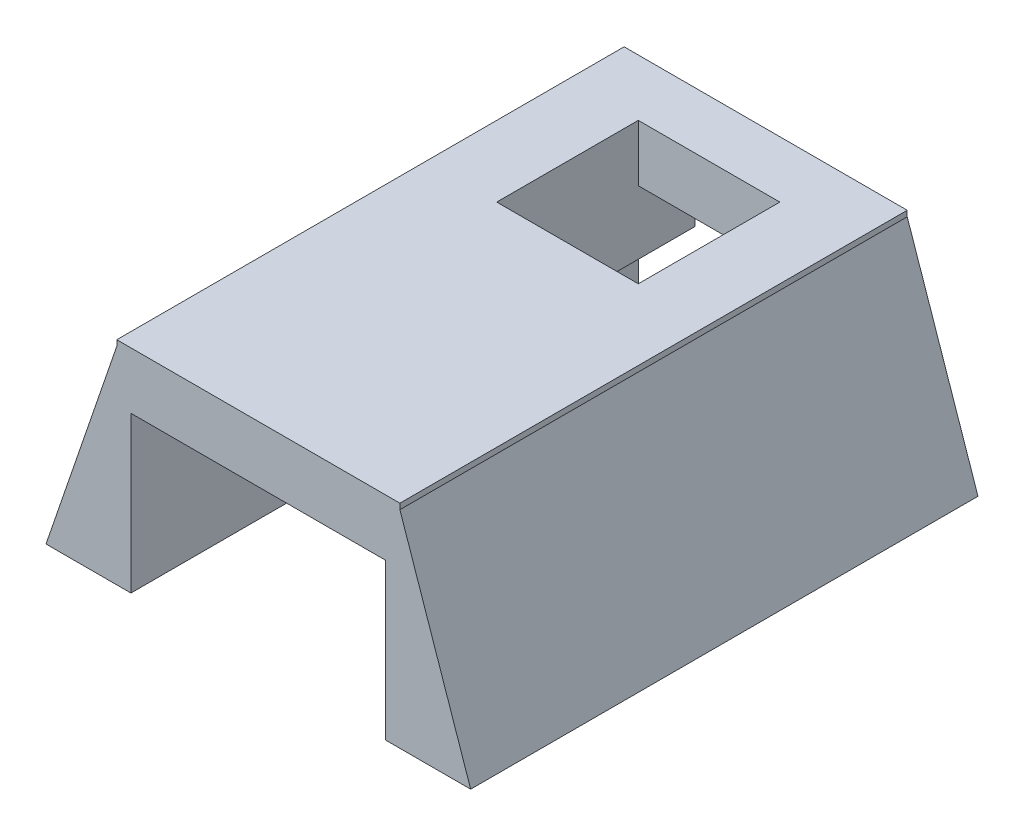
SolidWorks part; units mm, degrees
ref_plane "Front Plane" through (0, 0, 0) normal (0, 0, 1) x (1, 0, 0)
ref_plane "Top Plane" through (0, 0, 0) normal (0, 1, 0) x (1, 0, 0)
ref_plane "Right Plane" through (0, 0, 0) normal (1, 0, 0) x (0, 0, -1)
sketch "Sketch2" plane through (0, 0, 0) normal (0, 0, 1) x (1, 0, 0)
  line L0 (-7.5, 0) -> (-5, 7.3)
  line L1 (-5, 7.3) -> (-5, 7.5)
  line L2 (-5, 7.5) -> (5, 7.5)
  line L3 (0, 1.6079) -> (0, -0.5641) construction
  line L4 (-7.5, 0) -> (7.5, 0)
  line L5 (5, 7.3) -> (5, 7.5)
  line L6 (7.5, 0) -> (5, 7.3)
  point P9 (0, 0)
  point P10 (0, 7.5)
  dimension "D1" = 0.2
  dimension "D2" = 2.5
  dimension "D3" = 7.5
  dimension "D4" = 5
extrude "Boss-Extrude1" add sketch "Sketch2" along normal blind 19.9205
sketch "Sketch3" plane through (0, 0, 0) normal (0, 1, 0) x (1, 0, 0)
  line L0 (0, -19.9205) -> (0, -13.5866) construction
  line L1 (5, -19.9205) -> (-5, -19.9205) construction
  line L2 (-4.5, -19.9205) -> (4.5, -19.9205)
  line L3 (-2.5, 0) -> (2.5, 0)
  line L4 (-7.5, 0) -> (7.5, 0) construction
  line L5 (-2.5, -11) -> (-2.5, 0)
  line L7 (-2.5, -11) -> (-4.5, -11)
  line L8 (-4.5, -11) -> (-4.5, -19.9205)
  line L9 (-7.5, -19.9205) -> (7.5, -19.9205) construction
  line L10 (4.5, -11) -> (4.5, -19.9205)
  line L11 (2.5, -11) -> (4.5, -11)
  line L12 (2.5, -11) -> (2.5, 0)
  point P6 (0, -19.9205)
  point P10 (0, -19.9205)
  point P11 (0, 0)
  point P21 (0, 0)
  dimension "D1" = 2.5
  dimension "D2" = 9
  dimension "D3" = 11
extrude "Cut-Extrude3" cut sketch "Sketch3" along normal blind 5.5
sketch "Sketch5" plane through (0, 0, 0) normal (0, 0, -1) x (-1, 0, 0)
  line L0 (-4.5, 0) -> (-4.5, 3.25)
  line L1 (-2.5, 0) -> (-7.5, 0) construction
  line L2 (-4.5, 3.25) -> (4.5, 3.25)
  line L3 (4.5, 3.25) -> (4.5, 0)
  line L4 (4.5, 0) -> (-4.5, 0)
  line L5 (-2.5, 5.5) -> (2.5, 5.5) construction
  point P10 (0, 5.5)
  point P11 (0, 3.25)
  dimension "D1" = 9
  dimension "D2" = 2.25
extrude "Cut-Extrude5" cut sketch "Sketch5" against normal through all
sketch "Sketch6" plane through (0, 3.25, 0) normal (0, -1, 0) x (1, 0, 0)
  line L0 (6, 0) -> (-6, 0)
  line L1 (4.5, 0) -> (7.5, 0) construction
  line L2 (-7.5, 0) -> (-4.5, 0) construction
  line L3 (-6, 0) -> (-6, 2)
  line L4 (-6, 2) -> (6, 2)
  line L5 (6, 2) -> (6, 0)
  dimension "D1" = 2
extrude "Boss-Extrude2" add sketch "Sketch6" along normal up to surface (3.25 mm away)
sketch "Sketch7" plane through (0, 0, 0) normal (0, -1, 0) x (1, 0, 0)
  line L0 (3.5589, 0) -> (3.5589, 2)
  line L1 (-7.5, 0) -> (7.5, 0) construction
  line L2 (-4.5, 2) -> (4.5, 2) construction
  line L3 (3.5589, 2) -> (-3.5, 2)
  line L4 (-2.5, 2) -> (-4.5, 2) construction
  line L5 (-3.5, 2) -> (-3.5, 0)
  line L6 (-3.5, 0) -> (3.5589, 0)
extrude "Boss-Extrude3" add sketch "Sketch7" against normal blind 6
sketch "Sketch4" plane through (0, 7.5, 0) normal (0, 1, 0) x (1, 0, 0)
  line L0 (0, 0) -> (0, -11.2083) construction
  line L2 (2.5, -9) -> (-2.5, -9)
  line L3 (2.5, -9) -> (2.5, -4)
  line L4 (2.5, -4) -> (-2.5, -4)
  line L5 (-2.5, -9) -> (-2.5, -4)
  line L6 (2.5, -9) -> (-2.5, -4) construction
  line L7 (2.5, -4) -> (-2.5, -9) construction
  line L9 (2.5, -11) -> (2.5, -2) construction
  point P3 (0, -6.5)
  point P10 (2.5, -6.5)
  point P13 (2.5, -6.5)
  dimension "D1" = 5
  dimension "D2" = 5
extrude "Cut-Extrude4" cut sketch "Sketch4" against normal through all
sketch "Sketch8" plane through (0, 0, 0) normal (0, -1, 0) x (1, 0, 0)
  line L0 (-7.5, 19.9205) -> (-7.5, 0) construction
  line L1 (7.5, 0) -> (-7.5, 0)
  line L2 (7.5, 0) -> (7.5, 2)
  line L3 (7.5, 2) -> (-7.5, 2)
  line L4 (-7.5, 0) -> (-7.5, 2)
  dimension "D1" = 2
extrude "Cut-Extrude6" cut sketch "Sketch8" against normal up to next
